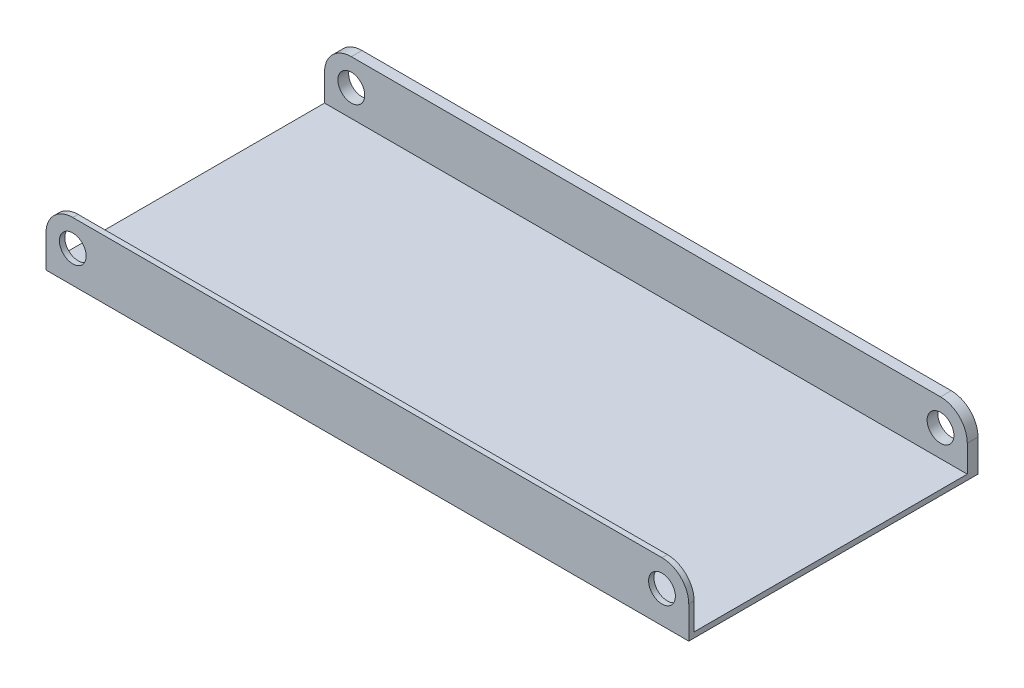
SolidWorks part; units mm, degrees
ref_plane "Front Plane" through (0, 0, 0) normal (0, 0, 1) x (1, 0, 0)
ref_plane "Top Plane" through (0, 0, 0) normal (0, 1, 0) x (1, 0, 0)
ref_plane "Right Plane" through (0, 0, 0) normal (1, 0, 0) x (0, 0, -1)
sketch "Sketch1" plane through (0, 0, 0) normal (0, 1, 0) x (1, 0, 0)
  line L1 (0, 0) -> (152.4, 0)
  line L2 (0, 0) -> (0, -68.58)
  line L3 (0, -68.58) -> (152.4, -68.58)
  line L4 (152.4, 0) -> (152.4, -68.58)
  dimension "D1" = 68.58
  dimension "D2" = 152.4
extrude "Boss-Extrude1" add sketch "Sketch1" along normal blind 1.27
sketch "Sketch2" plane through (0, 1.27, 0) normal (0, 1, 0) x (1, 0, 0)
  line L0 (152.4, -68.58) -> (152.4, 0) construction
  line L1 (0, -68.58) -> (152.4, -68.58)
  line L2 (0, -68.58) -> (0, -67.31)
  line L3 (0, -67.31) -> (152.4, -67.31)
  line L4 (152.4, -68.58) -> (152.4, -67.31)
  line L6 (0, 0) -> (152.4, 0)
  line L7 (0, 0) -> (0, -2.54)
  line L8 (0, -2.54) -> (152.4, -2.54)
  line L9 (152.4, 0) -> (152.4, -2.54)
  point P12 (152.4, -1.27)
  dimension "D1" = 1.27
  dimension "D2" = 1.27
extrude "Boss-Extrude2" add sketch "Sketch2" along normal blind 12.7
sketch "Sketch3" plane through (0, 0, 68.58) normal (0, 0, 1) x (1, 0, 0)
  line L0 (0, 13.97) -> (0, 0) construction
  line L2 (0, 13.97) -> (152.4, 13.97) construction
  line L3 (152.4, 13.97) -> (152.4, 0) construction
  circle A0 centre (6.35, 7.62) radius 3.175
  circle A1 centre (146.05, 7.62) radius 3.175
  dimension "D1" = 6.35
  dimension "D2" = 6.35
  dimension "D3" = 6.35
  dimension "D4" = 6.35
  dimension "D5" = 6.35
  dimension "D6" = 6.35
extrude "Cut-Extrude1" cut sketch "Sketch3" against normal through all
fillet "Fillet1" radius 6.35 4 edges at (152.4, 13.97, 67.945) (152.4, 13.97, 1.27) (0, 13.97, 1.27) (0, 13.97, 67.945)
